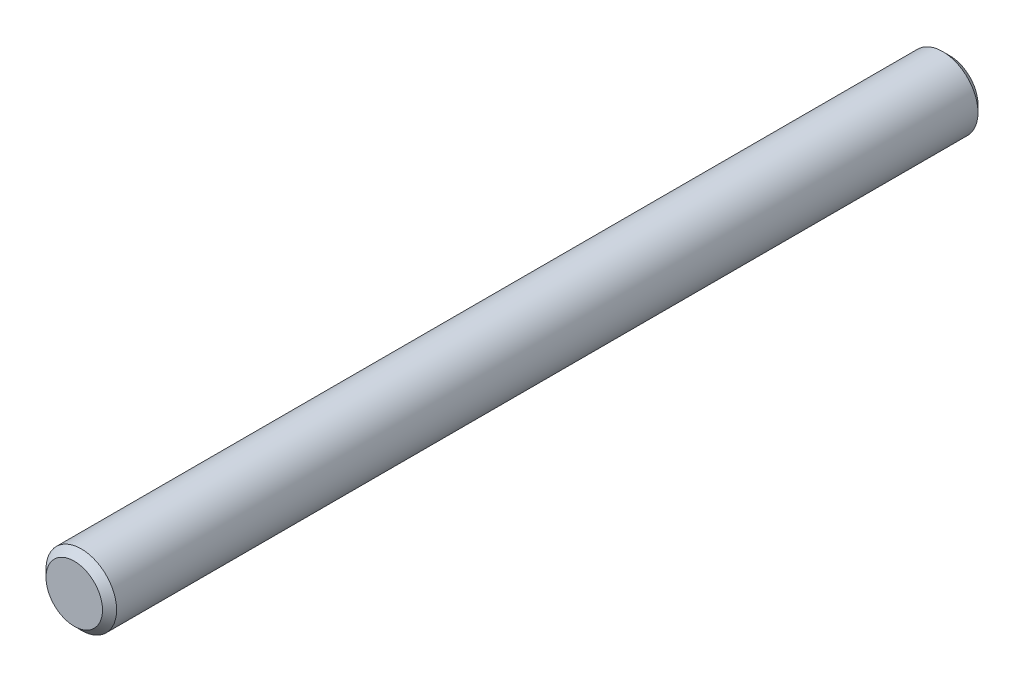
SolidWorks part; units mm, degrees
ref_plane "Plan1" through (0, 0, 0) normal (0, 0, 1) x (1, 0, 0)
ref_plane "Plan2" through (0, 0, 0) normal (0, 1, 0) x (1, 0, 0)
ref_plane "Plan3" through (0, 0, 0) normal (1, 0, 0) x (0, 0, -1)
sketch "Esquisse1" plane through (0, 0, 0) normal (0, 0, 1) x (1, 0, 0)
  circle A0 centre (0, 0) radius 5
  dimension "D1" = 10
extrude "Base-Extrusion" add sketch "Esquisse1" along normal blind 124
chamfer "Chanfrein1" distance 1 angle 45
